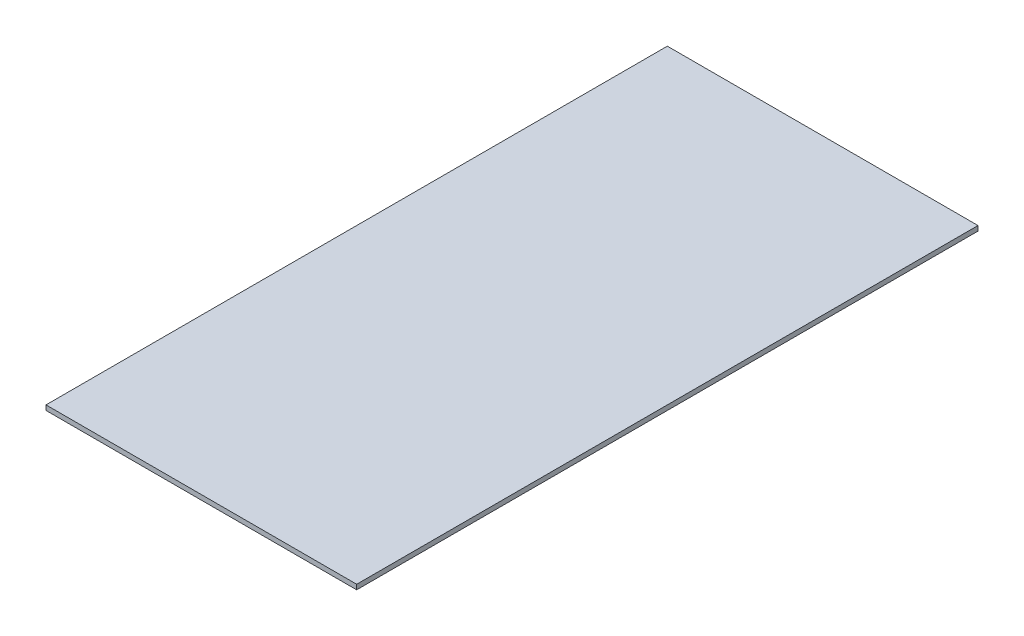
SolidWorks part; units mm, degrees
ref_plane "Front Plane" through (0, 0, 0) normal (0, 0, 1) x (1, 0, 0)
ref_plane "Top Plane" through (0, 0, 0) normal (0, 1, 0) x (1, 0, 0)
ref_plane "Right Plane" through (0, 0, 0) normal (1, 0, 0) x (0, 0, -1)
sketch "Sketch1" plane through (0, 0, 0) normal (0, 1, 0) x (1, 0, 0)
  line L1 (0, 0) -> (1219.2, 0)
  line L2 (0, 0) -> (0, 2438.4)
  line L3 (0, 2438.4) -> (1219.2, 2438.4)
  line L4 (1219.2, 0) -> (1219.2, 2438.4)
  dimension "D1" = 1219.2
  dimension "D2" = 2438.4
extrude "Extrude1" add sketch "Sketch1" along normal blind 19.05
